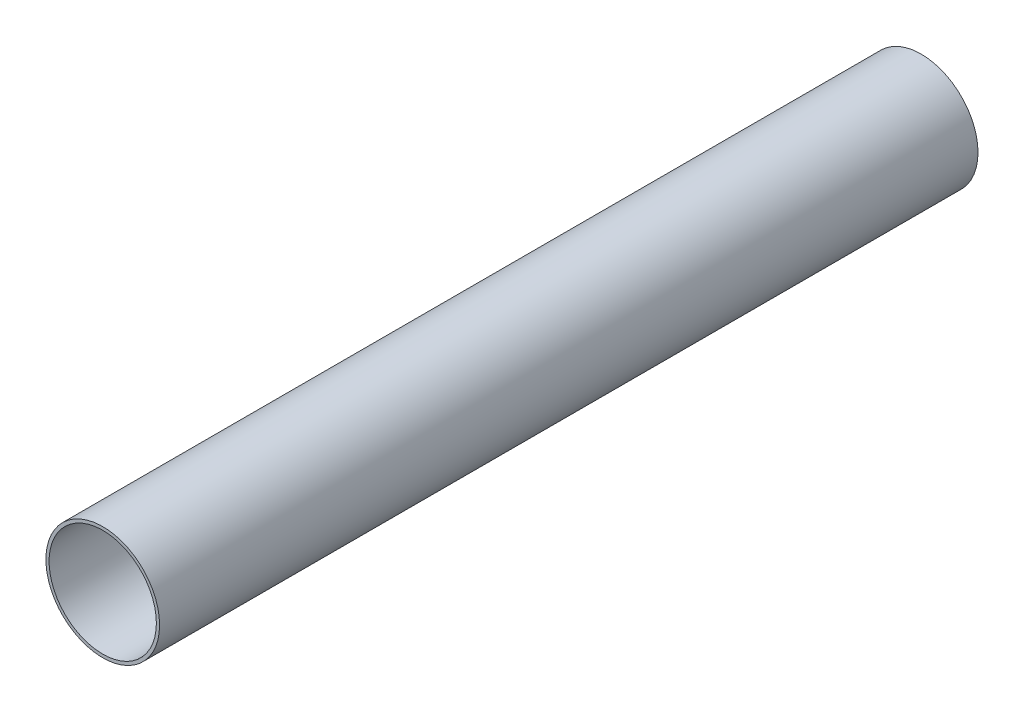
SolidWorks part; units mm, degrees
ref_plane "Front Plane" through (0, 0, 0) normal (0, 0, 1) x (1, 0, 0)
ref_plane "Top Plane" through (0, 0, 0) normal (0, 1, 0) x (1, 0, 0)
ref_plane "Right Plane" through (0, 0, 0) normal (1, 0, 0) x (0, 0, -1)
sketch "Sketch1" plane through (0, 0, 0) normal (0, 0, 1) x (1, 0, 0)
  circle A0 centre (0, 0) radius 29.9641
  circle A1 centre (0, 0) radius 31.75
  dimension "D1" = 59.9281
  dimension "D2" = 63.5
extrude "Boss-Extrude1" add sketch "Sketch1" along normal blind 457.2
